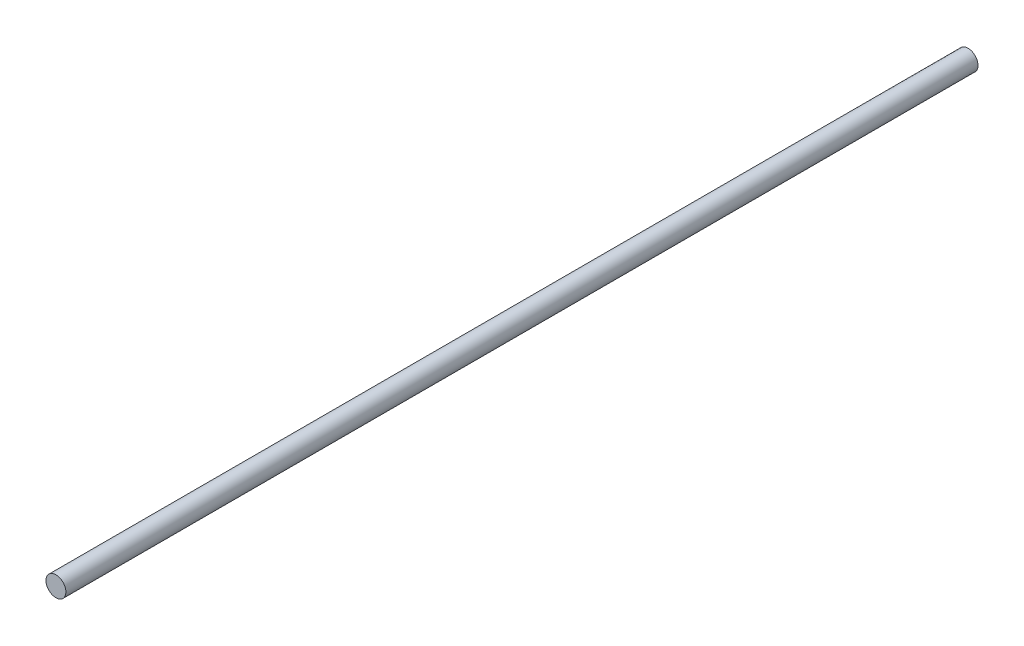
SolidWorks part; units mm, degrees
ref_plane "Front Plane" through (0, 0, 0) normal (0, 0, 1) x (1, 0, 0)
ref_plane "Top Plane" through (0, 0, 0) normal (0, 1, 0) x (1, 0, 0)
ref_plane "Right Plane" through (0, 0, 0) normal (1, 0, 0) x (0, 0, -1)
sketch "Sketch1" plane through (0, 0, 0) normal (0, 0, 1) x (1, 0, 0)
  circle A0 centre (0, 0) radius 30
  dimension "D1" = 60
extrude "Boss-Extrude1" add sketch "Sketch1" against normal blind 2750
